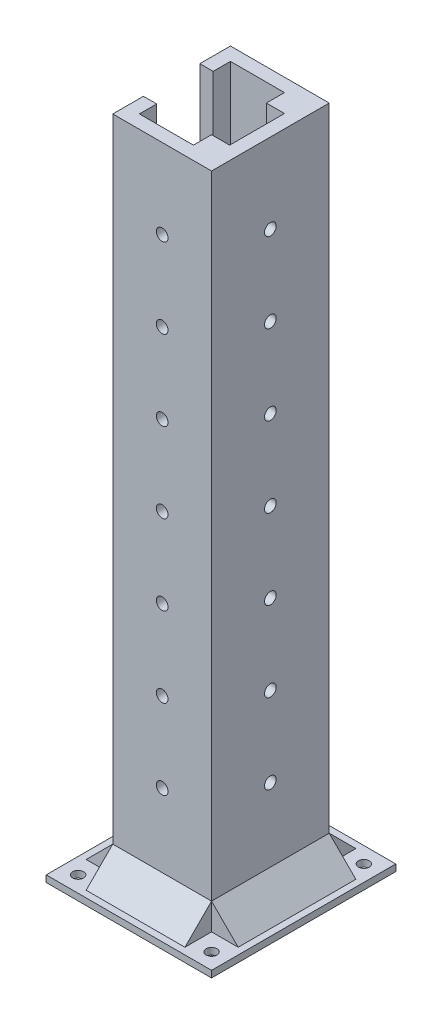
SolidWorks part; units mm, degrees
ref_plane "Front Plane" through (0, 0, 0) normal (0, 0, 1) x (1, 0, 0)
ref_plane "Top Plane" through (0, 0, 0) normal (0, 1, 0) x (1, 0, 0)
ref_plane "Right Plane" through (0, 0, 0) normal (1, 0, 0) x (0, 0, -1)
sketch "Sketch1" plane through (0, 0, 0) normal (0, 1, 0) x (1, 0, 0)
  line L0 (0, 0) -> (37.1, 0)
  line L1 (37.1, 0) -> (37.1, 44.2)
  line L2 (37.1, 44.2) -> (0, 44.2)
  line L3 (0, 44.2) -> (0, 32.7)
  line L4 (0, 32.7) -> (5, 32.7)
  line L5 (5, 32.7) -> (5, 39.2)
  line L6 (5, 39.2) -> (25.3, 39.2)
  line L7 (25.3, 39.2) -> (25.3, 32.4)
  line L8 (25.3, 32.4) -> (32.1, 32.4)
  line L9 (32.1, 32.4) -> (32.1, 11.8)
  line L10 (32.1, 11.8) -> (25.3, 11.8)
  line L11 (25.3, 11.8) -> (25.3, 5)
  line L12 (25.3, 5) -> (5, 5)
  line L13 (5, 5) -> (5, 11.5)
  line L14 (5, 11.5) -> (0, 11.5)
  line L15 (0, 11.5) -> (0, 0)
extrude "Boss-Extrude1" add sketch "Sketch1" along normal blind 250 contours L6 L7 L8 L9 L10 L11 L12 L13 L14 L15 L0 L1 L2 L3 L4 L5
sketch "Sketch2" plane through (0, 0, 0) normal (0, -1, 0) x (-1, 0, 0)
  line L0 (-37.1, 44.2) -> (0, 44.2) construction
  line L1 (12.5, -12.5) -> (-49.6, -12.5)
  line L2 (12.5, -12.5) -> (12.5, 56.7)
  line L3 (12.5, 56.7) -> (-49.6, 56.7)
  line L4 (-49.6, -12.5) -> (-49.6, 56.7)
  line L5 (12.5, -12.5) -> (-49.6, 56.7) construction
  line L6 (12.5, 56.7) -> (-49.6, -12.5) construction
  line L7 (-37.1, 0) -> (-37.1, 44.2) construction
  line L8 (-18.55, 44.2) -> (-18.55, 0) construction
  line L9 (0, 0) -> (-37.1, 0) construction
  line L10 (-37.1, 22.1) -> (0, 22.1) construction
  circle A0 centre (-43.6, 50.7) radius 2.05
  circle A1 centre (6.5, 50.7) radius 2.05
  circle A2 centre (6.5, -6.5) radius 2.05
  circle A3 centre (-43.6, -6.5) radius 2.05
  point P0 (-18.55, 22.1)
  point P5 (-18.55, 44.2)
  point P9 (-37.1, 22.1)
  dimension "D3" = 4.1
  dimension "D1" = 12.5
  dimension "D2" = 12.5
  dimension "D4" = 6
  dimension "D5" = 6
extrude "Boss-Extrude2" add sketch "Sketch2" against normal blind 2.5
sketch "Sketch3" plane through (0, 0, -44.2) normal (0, 0, -1) x (-1, 0, 0)
  line L0 (-37.1, 250) -> (0, 250) construction
  circle A0 centre (-18.55, 220) radius 2.2
  circle A1 centre (-18.55, 190) radius 2.2
  circle A2 centre (-18.55, 160) radius 2.2
  circle A3 centre (-18.55, 130) radius 2.2
  circle A4 centre (-18.55, 100) radius 2.2
  circle A5 centre (-18.55, 70) radius 2.2
  circle A6 centre (-18.55, 40) radius 2.2
  point P2 (-18.55, 250)
  dimension "D1" = 4.4
  dimension "D2" = 30
  dimension "D3" = 7
extrude "Cut-Extrude1" cut sketch "Sketch3" against normal blind 70
sketch "Sketch4" plane through (37.1, 0, 0) normal (1, 0, 0) x (0, 0, -1)
  line L0 (0, 250) -> (44.2, 250) construction
  circle A0 centre (22.1, 220) radius 2.2
  circle A1 centre (22.1, 190) radius 2.2
  circle A2 centre (22.1, 160) radius 2.2
  circle A3 centre (22.1, 130) radius 2.2
  circle A4 centre (22.1, 100) radius 2.2
  circle A5 centre (22.1, 70) radius 2.2
  circle A6 centre (22.1, 40) radius 2.2
  point P2 (22.1, 250)
  dimension "D1" = 4.4
  dimension "D2" = 30
  dimension "D3" = 7
extrude "Cut-Extrude2" cut sketch "Sketch4" against normal blind 70
sketch "Sketch5" plane through (0, 0, 0) normal (0, -1, 0) x (1, 0, 0)
  line L0 (49.6, 12.5) -> (-12.5, 12.5) construction
  line L1 (37.1, -44.2) -> (0, -44.2)
  line L2 (37.1, -44.2) -> (37.1, 0)
  line L3 (37.1, 0) -> (0, 0)
  line L4 (0, -44.2) -> (0, 0)
  line L5 (37.1, -44.2) -> (0, 0) construction
  line L6 (37.1, 0) -> (0, -44.2) construction
  line L7 (-12.5, 12.5) -> (-12.5, -56.7) construction
  line L8 (32.1, -5) -> (5, -5)
  line L9 (5, -39.2) -> (5, -5)
  line L10 (32.1, -39.2) -> (5, -39.2)
  line L11 (32.1, -39.2) -> (32.1, -5)
  point P0 (18.55, -22.1)
  point P5 (18.55, 12.5)
  point P6 (-12.5, -22.1)
  dimension "D1" = 37.1
  dimension "D2" = 44.2
  dimension "D3" = 5
extrude "Boss-Extrude3" add sketch "Sketch5" along normal blind 10.16
chamfer "Chamfer1" distance 10 angle 45 3 edges at (37.1, 2.5, -22.1) (0, 2.5, -38.45) (0, 2.5, -5.75)
ref_plane "Plane1" through (18.55, 0, 0) normal (-1, 0, 0) x (0, 0, 1)
sketch "Sketch6" plane through (18.55, 0, 0) normal (-1, 0, 0) x (0, 0, 1)
  line L0 (-44.2, 2.5) -> (-54.2, 2.5)
  line L1 (12.5, 2.5) -> (-56.7, 2.5) construction
  line L2 (-54.2, 2.5) -> (-44.2, 12.5)
  line L3 (-44.2, 250) -> (-44.2, 12.5) construction
  line L4 (-44.2, 12.5) -> (-44.2, 2.5)
  line L5 (0, 2.5) -> (10, 2.5)
  line L6 (10, 2.5) -> (0, 12.5)
  line L7 (0, 250) -> (0, 12.5) construction
  line L8 (0, 12.5) -> (0, 2.5)
  dimension "D1" = 45
  dimension "D2" = 10
  dimension "D3" = 10
  dimension "D4" = 45
extrude "Boss-Extrude4" add sketch "Sketch6" along normal mid plane 37.1 contours L2 L4 L0 | L6 L8 L5
equation "\"clearance\"= 0.3"
equation "\"D1@Sketch1\"=6.5+\"clearance\""
equation "\"D2@Sketch1\"=6.5 + \"clearance\""
equation "\"D3@Sketch1\"=20+2*\"clearance\""
equation "\"D4@Sketch1\"=20+\"clearance\""
equation "\"D6@Sketch1\"=\"clearance\""
